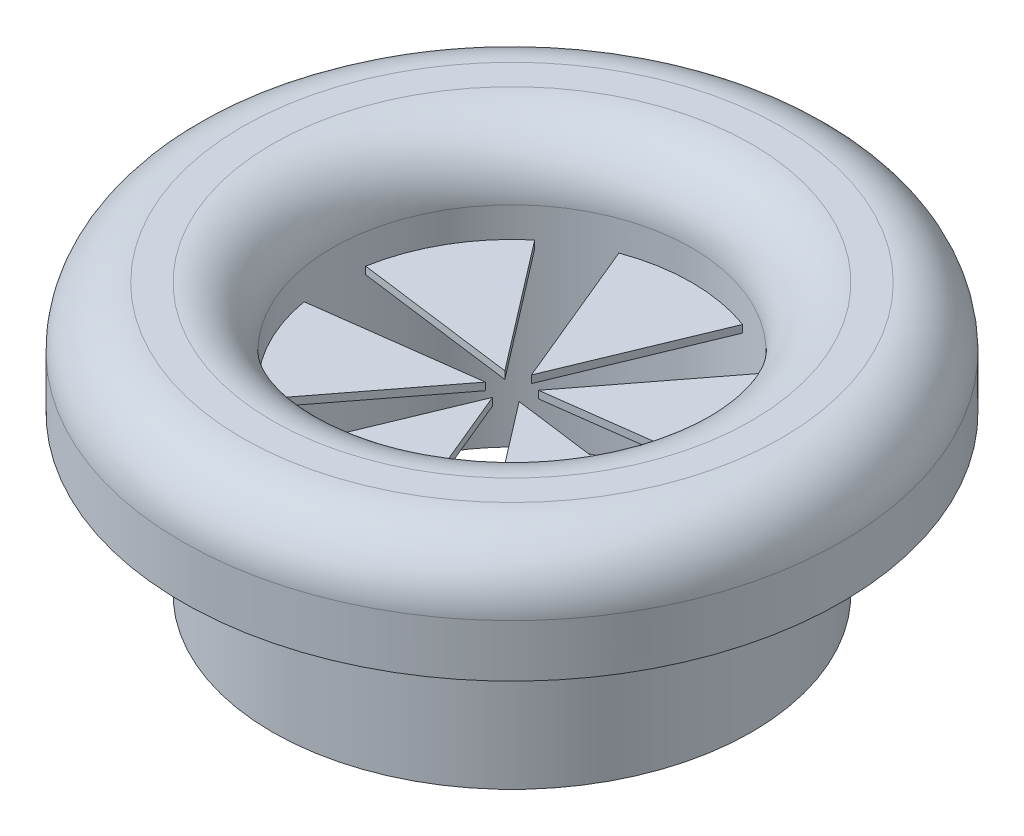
SolidWorks part; units mm, degrees
ref_plane "Front Plane" through (0, 0, 0) normal (0, 0, 1) x (1, 0, 0)
ref_plane "Top Plane" through (0, 0, 0) normal (0, 1, 0) x (1, 0, 0)
ref_plane "Right Plane" through (0, 0, 0) normal (1, 0, 0) x (0, 0, -1)
sketch "Sketch1" plane through (0, 0, 0) normal (0, 1, 0) x (1, 0, 0)
  circle A0 centre (0, 0) radius 8
  dimension "D1" = 16
extrude "Boss-Extrude1" add sketch "Sketch1" along normal blind 5
sketch "Sketch2" plane through (0, 5, 0) normal (0, 1, 0) x (1, 0, 0)
  circle A0 centre (0, 0) radius 11
  dimension "D1" = 22
extrude "Boss-Extrude2" add sketch "Sketch2" along normal blind 4
sketch "Sketch3" plane through (0, 9, 0) normal (0, 1, 0) x (1, 0, 0)
  circle A0 centre (0, 0) radius 6
  dimension "D1" = 12
extrude "Cut-Extrude1" cut sketch "Sketch3" against normal through all
sketch "Sketch4" plane through (0, 0, 0) normal (0, -1, 0) x (1, 0, 0)
  line L0 (0, 6) -> (0, 0) construction
  line L1 (0, 0.65) -> (-2.0643, 5.6337)
  line L2 (0, 0.65) -> (2.0643, 5.6337)
  line L3 (0.5629, 0.325) -> (3.8468, 4.6046)
  line L4 (0.5629, 0.325) -> (5.9111, 1.0291)
  line L5 (0.5629, -0.325) -> (5.9111, -1.0291)
  line L6 (0.5629, -0.325) -> (3.8468, -4.6046)
  line L7 (0, -0.65) -> (2.0643, -5.6337)
  line L8 (0, -0.65) -> (-2.0643, -5.6337)
  line L9 (-0.5629, -0.325) -> (-3.8468, -4.6046)
  line L10 (-0.5629, -0.325) -> (-5.9111, -1.0291)
  line L11 (-0.5629, 0.325) -> (-5.9111, 1.0291)
  line L12 (-0.5629, 0.325) -> (-3.8468, 4.6046)
  circle A0 centre (0, 0) radius 6 construction
  arc A1 (-2.0643, 5.6337) -> (2.0643, 5.6337) centre (0, 0) cw
  arc A2 (3.8468, 4.6046) -> (5.9111, 1.0291) centre (0, 0) cw
  arc A3 (5.9111, -1.0291) -> (3.8468, -4.6046) centre (0, 0) cw
  arc A4 (2.0643, -5.6337) -> (-2.0643, -5.6337) centre (0, 0) cw
  arc A5 (-3.8468, -4.6046) -> (-5.9111, -1.0291) centre (0, 0) cw
  arc A6 (-5.9111, 1.0291) -> (-3.8468, 4.6046) centre (0, 0) cw
  point P26 (0, 0)
  dimension "D1" = 45
  dimension "D2" = 0.65
  dimension "D3" = 6
extrude "Boss-Extrude3" add sketch "Sketch4" along normal blind 0.25 from offset 6
sketch "Sketch5" plane through (0, 5, 0) normal (0, -1, 0) x (1, 0, 0)
  circle A0 centre (0, 0) radius 10
  circle A1 centre (0, 0) radius 11
  circle A2 centre (0, 0) radius 11
  dimension "D1" = 0
  dimension "D2" = 1
extrude "Cut-Extrude2" cut sketch "Sketch5" against normal blind 0.25
fillet "Fillet1" radius 2 2 edges at (0, 9, 11) (0, 9, 6)
